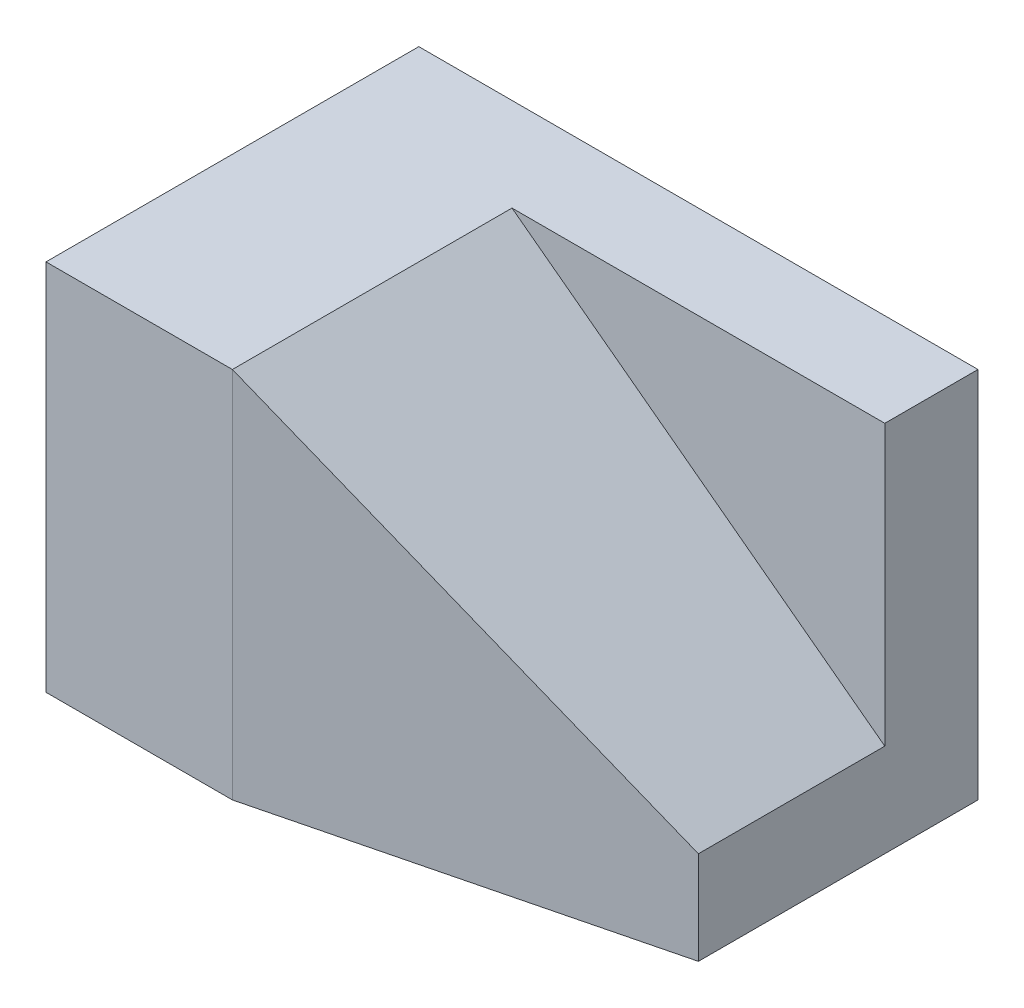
SolidWorks part; units mm, degrees
ref_plane "Front Plane" through (0, 0, 0) normal (0, 0, 1) x (1, 0, 0)
ref_plane "Top Plane" through (0, 0, 0) normal (0, 1, 0) x (1, 0, 0)
ref_plane "Right Plane" through (0, 0, 0) normal (1, 0, 0) x (0, 0, -1)
sketch "Sketch1" plane through (0, 0, 0) normal (0, 1, 0) x (1, 0, 0)
  line L0 (-30, -20) -> (30, 20) construction
  line L1 (-30, -20) -> (30, -20)
  line L2 (-30, -20) -> (-30, 20)
  line L3 (-30, 20) -> (30, 20)
  line L4 (30, -20) -> (30, 20)
  dimension "D1" = 40
  dimension "D2" = 60
extrude "Extrude1" add sketch "Sketch1" along normal blind 40
sketch "Sketch2" plane through (0, 0, 20) normal (0, 0, 1) x (1, 0, 0)
  line L0 (-10, 40) -> (30, 10)
  line L1 (-30, 40) -> (30, 40) construction
  line L2 (30, 40) -> (30, 0) construction
  line L3 (30, 10) -> (30, 40)
  line L4 (30, 40) -> (-10, 40)
  dimension "D1" = 40
  dimension "D2" = 30
extrude "Extrude2" cut sketch "Sketch2" against normal blind 30
chamfer "Chamfer1" distance 40 distance2 10 1 edges at (30, 5, 20)
